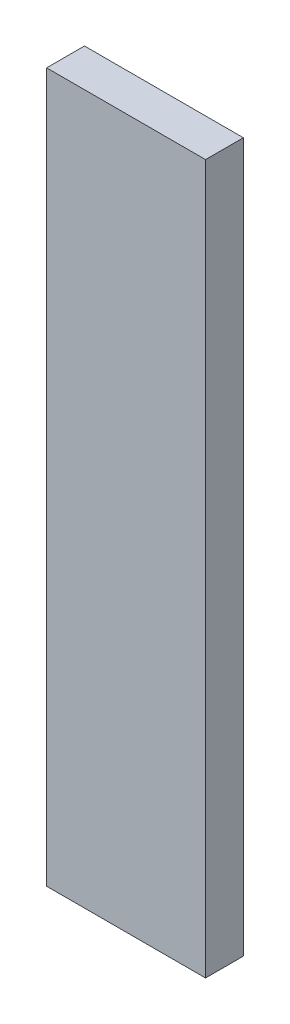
SolidWorks part; units mm, degrees
ref_plane "Спереди" through (0, 0, 0) normal (0, 0, 1) x (1, 0, 0)
ref_plane "Сверху" through (0, 0, 0) normal (0, 1, 0) x (1, 0, 0)
ref_plane "Справа" through (0, 0, 0) normal (1, 0, 0) x (0, 0, -1)
sketch "Эскиз1" plane through (0, 0, 0) normal (0, 0, 1) x (1, 0, 0)
  line L1 (157.5, 702.5) -> (-157.5, 702.5)
  line L2 (157.5, 702.5) -> (157.5, -702.5)
  line L3 (157.5, -702.5) -> (-157.5, -702.5)
  line L4 (-157.5, 702.5) -> (-157.5, -702.5)
  line L5 (157.5, 702.5) -> (-157.5, -702.5) construction
  line L6 (157.5, -702.5) -> (-157.5, 702.5) construction
  point P0 (0, 0)
  dimension "D1" = 315
  dimension "D2" = 1405
extrude "Бобышка-Вытянуть1" add sketch "Эскиз1" against normal blind 75
